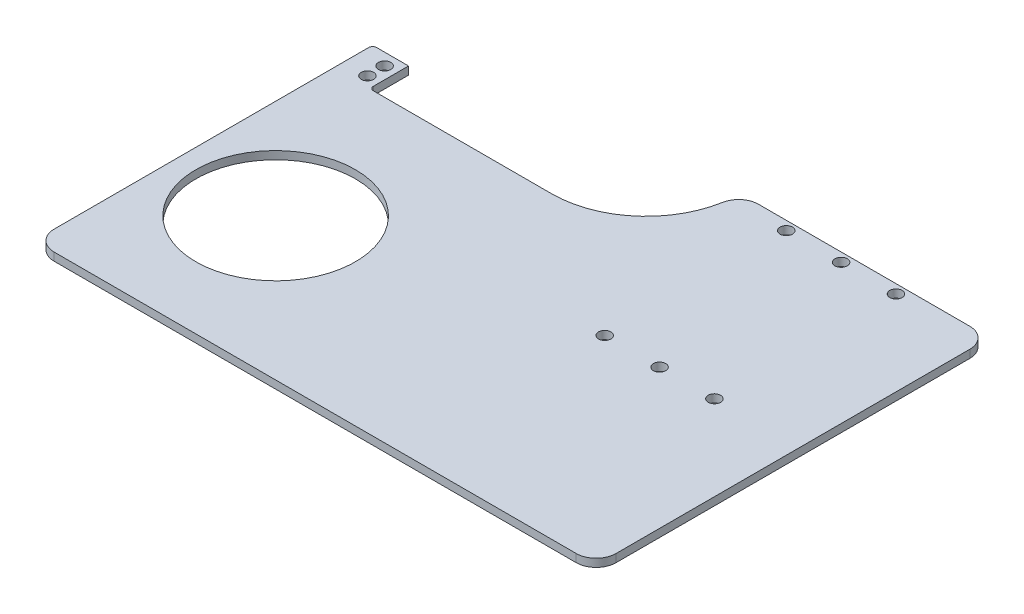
SolidWorks part; units mm, degrees
ref_plane "Plano frontal" through (0, 0, 0) normal (0, 0, 1) x (1, 0, 0)
ref_plane "Plano superior" through (0, 0, 0) normal (0, 1, 0) x (1, 0, 0)
ref_plane "Plano direito" through (0, 0, 0) normal (1, 0, 0) x (0, 0, -1)
sketch "Esboço1" plane through (0, 0, 0) normal (0, 1, 0) x (1, 0, 0)
  line L1 (-75, -100) -> (325, -100)
  line L2 (-75, -100) -> (-75, 150)
  line L3 (-75, 150) -> (325, 150)
  line L4 (325, -100) -> (325, 150)
  point P0 (0, 0)
  dimension "D3" = 100
  dimension "D1" = 250
  dimension "D2" = 400
  dimension "D4" = 75
extrude "Ressalto-extrusão1" add sketch "Esboço1" along normal blind 4
sketch "Esboço2" plane through (0, 4, 0) normal (0, 1, 0) x (1, 0, 0)
  line L1 (111.65, 170.2584) -> (111.65, -14.347) construction
  line L2 (211.8423, 140) -> (211.8423, 40) construction
  line L3 (211.8423, 40) -> (101.8423, 40) construction
  line L5 (0, 0) -> (0, 90) construction
  line L6 (0, 44.5) -> (271.1635, 44.5) construction
  line L7 (0, 90) -> (431.5449, 90) construction
  line L8 (0, 135.5) -> (271.1635, 135.5) construction
  line L9 (0, 140) -> (271.1635, 140) construction
  line L10 (211.8423, 40) -> (211.8423, 140) construction
  line L11 (211.8423, 40) -> (101.8423, 40) construction
  line L12 (101.8423, 40) -> (101.8423, 140) construction
  point P19 (0, 0)
  point P24 (101.8423, 140)
  dimension "D1" = 90
  dimension "D2" = 45.5
  dimension "D3" = 4.5
  dimension "D4" = 45.5
  dimension "D5" = 111.65
sketch "Esboço3" plane through (0, 4, 0) normal (0, 1, 0) x (1, 0, 0)
  line L16 (24.8962, 81) -> (24.8962, 99) construction
  line L17 (24.8962, 81) -> (24.8962, 99) construction
  line L18 (24.8962, 99) -> (-48.5185, 99) construction
  line L19 (24.8962, 81) -> (-41.4165, 81) construction
sketch "Esboço4" plane through (0, 4, 0) normal (0, 1, 0) x (1, 0, 0)
  line L1 (-75, 150) -> (325, 150)
  line L2 (-75, 150) -> (-75, -100)
  line L3 (-75, -100) -> (325, -100)
  line L4 (325, 150) -> (325, -100)
  line L5 (-36.8038, 112.3206) -> (-36.8038, 94.7051)
  line L6 (-34.8038, 92.7051) -> (54.5474, 92.7051)
  line L8 (110.9628, 140) -> (216.8423, 140)
  line L9 (226.8423, 130) -> (226.8423, -47.2949)
  line L10 (216.8423, -57.2949) -> (-44.8038, -57.2949)
  line L11 (-54.8038, -47.2949) -> (-54.8038, 110.3206)
  line L12 (0, 140) -> (271.1635, 140) construction
  line L13 (211.8423, 140) -> (211.8423, 40) construction
  line L14 (101.8423, 40) -> (101.8423, 140) construction
  line L15 (-39.8038, 83.5) -> (-39.8038, 109.3206) construction
  line L17 (-39.8038, 83.5) -> (-39.8038, 109.3206) construction
  line L18 (-52.8038, 112.3206) -> (-36.8038, 112.3206)
  line L19 (-52.8038, 112.3206) -> (-36.8038, 112.3206) construction
  line L20 (-52.8038, 112.3206) -> (-36.8038, 112.3206) construction
  line L23 (29.5962, 92.7051) -> (29.5962, 87.2949) construction
  line L24 (29.5962, 92.7051) -> (29.5962, 87.2949) construction
  arc A0 (54.5474, 92.7051) -> (101.1163, 131.7454) centre (54.5474, 140) ccw
  arc A1 (-36.8038, 94.7051) -> (-34.8038, 92.7051) centre (-34.8038, 94.7051) ccw
  arc A2 (101.1163, 131.7454) -> (110.9628, 140) centre (110.9628, 130) cw
  arc A3 (216.8423, 140) -> (226.8423, 130) centre (216.8423, 130) cw
  arc A4 (226.8423, -47.2949) -> (216.8423, -57.2949) centre (216.8423, -47.2949) cw
  arc A5 (-44.8038, -57.2949) -> (-54.8038, -47.2949) centre (-44.8038, -47.2949) cw
  arc A6 (-52.8038, 112.3206) -> (-54.8038, 110.3206) centre (-52.8038, 110.3206) ccw
  point P35 (101.8423, 140)
  point P46 (-54.8038, 112.3206)
  dimension "D2" = 150
  dimension "D4" = 2
  dimension "D5" = 10
  dimension "D6" = 2
  dimension "D1" = 15
  dimension "D3" = 18
  dimension "D7" = 3
extrude "Corte-extrusão2" cut sketch "Esboço4" against normal blind 4 contours L2 L1 L4 L3 | L11 A6 L18 L5 A1 L6 A0 A2 L8 A3 L9 A4 L10 A5
sketch "Esboço5" plane through (0, 4, 0) normal (0, 1, 0) x (1, 0, 0)
  line L4 (24.8962, 99) -> (-48.5185, 99) construction
  line L5 (-5.1038, 14) -> (-5.1038, 109.7565) construction
  line L6 (29.5962, 92.7) -> (-39.8038, 92.7) construction
  line L7 (29.5962, 92.7) -> (-39.8038, 92.7) construction
  circle A0 centre (-42.8038, 106.3206) radius 3.1
  circle A1 centre (-42.8038, 97.7206) radius 3.1
  circle A2 centre (129.3423, 135.5) radius 3.1
  circle A3 centre (156.8423, 135.5) radius 3.1
  circle A4 centre (184.3423, 135.5) radius 3.1
  circle A5 centre (184.3423, 44.5) radius 3.1
  circle A6 centre (156.8423, 44.5) radius 3.1
  circle A7 centre (129.3423, 44.5) radius 3.1
  circle A9 centre (-5.1038, 14) radius 40
  circle A11 centre (-42.8038, 106.3206) radius 1.3 construction
  circle A12 centre (-42.8038, 97.7206) radius 1.3 construction
  circle A13 centre (129.3423, 44.5) radius 1.6 construction
  circle A14 centre (156.8423, 44.5) radius 1.6 construction
  circle A15 centre (184.3423, 44.5) radius 1.6 construction
  circle A16 centre (129.3423, 135.5) radius 1.6 construction
  circle A17 centre (156.8423, 135.5) radius 1.6 construction
  circle A18 centre (184.3423, 135.5) radius 1.6 construction
  point P29 (-5.1038, 92.7)
  dimension "D1" = 6.2
  dimension "D2" = 80
  dimension "D3" = 85
extrude "Corte-extrusão3" cut sketch "Esboço5" against normal up to next
